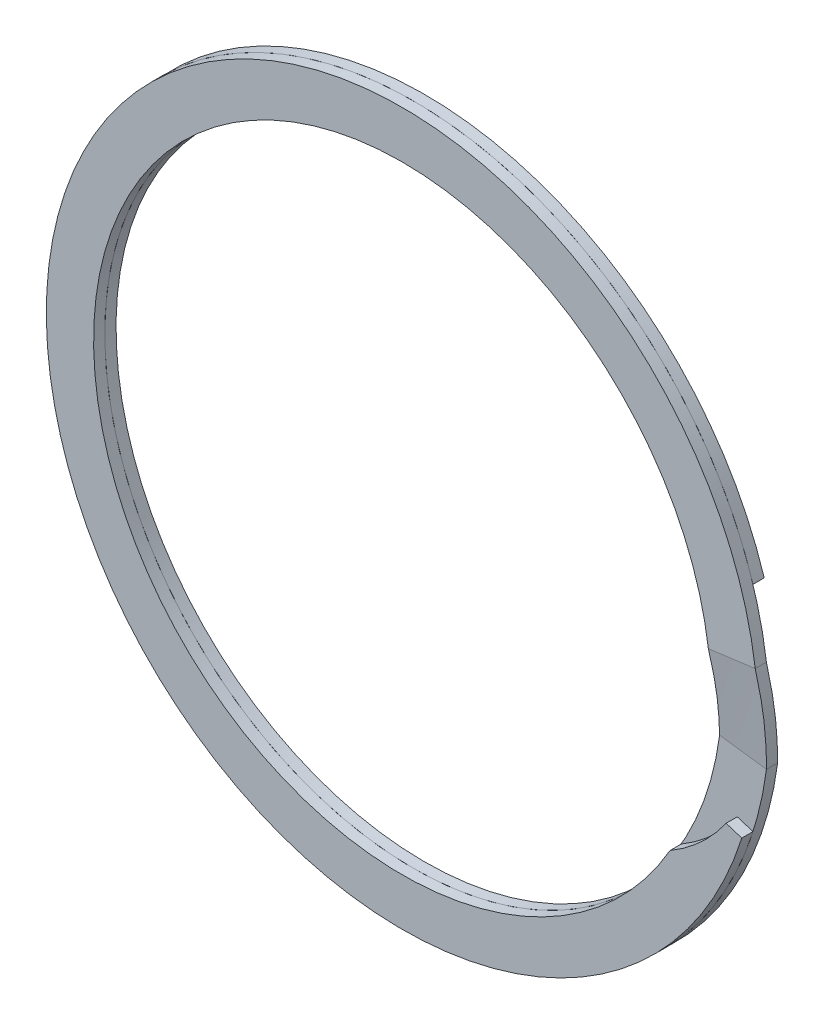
SolidWorks part; units mm, degrees
ref_plane "Front" through (0, 0, 0) normal (0, 0, 1) x (1, 0, 0)
ref_plane "Top" through (0, 0, 0) normal (0, 1, 0) x (1, 0, 0)
ref_plane "Right" through (0, 0, 0) normal (1, 0, 0) x (0, 0, -1)
sketch "Layout" plane through (0, 0, 0) normal (0, 0, 1) x (1, 0, 0)
  line L0 (-38.25, 0) -> (38.25, 0) construction
  line L1 (0, 0) -> (36.4797, 11.502) construction
  line L2 (0, 0) -> (36.4797, -11.502) construction
  line L3 (0, 0) -> (2.41, 0) construction
  line L4 (38.25, 0) -> (40.66, 0) construction
  line L9 (-38.25, 0) -> (-38.25, 2.41) construction
  line L10 (0, 0) -> (37.9228, 4.9926) construction
  line L11 (0, 0) -> (37.9228, -4.9926) construction
  circle A0 centre (0, 0) radius 33.17 construction
  circle A1 centre (0, 0) radius 38.25 construction
  circle A2 centre (19.125, 0) radius 19.125 construction
sketch "Sketch5" plane through (0, 0, 0) normal (0, 1, 0) x (1, 0, 0)
  line L0 (-38.25, 0) -> (38.25, 0) construction
  line L1 (33.17, 0.0025) -> (38.25, 0.0025) construction
  line L2 (33.17, 0.0025) -> (33.17, 1.205) construction
  line L3 (33.17, 1.205) -> (38.25, 1.205) construction
  line L4 (38.25, 0.0025) -> (38.25, 1.205) construction
  line L5 (0, 0) -> (0, 11.5256) construction
  line L9 (-38.25, 0) -> (38.25, 0) construction
  line L15 (33.17, -0.0025) -> (38.25, -0.0025) construction
  line L16 (33.17, -0.0025) -> (33.17, -1.205) construction
  line L17 (38.25, -0.0025) -> (38.25, -1.205) construction
  line L18 (33.17, -1.205) -> (38.25, -1.205) construction
  line L19 (-38.25, -0.0025) -> (-38.25, -1.205)
  line L20 (-38.25, 0.0025) -> (-38.25, 1.205)
  line L21 (-33.17, -0.0025) -> (-38.25, -0.0025)
  line L22 (-33.17, 0.0025) -> (-38.25, 0.0025)
  line L23 (-33.17, -1.205) -> (-38.25, -1.205)
  line L24 (-33.17, -0.0025) -> (-33.17, -1.205)
  line L25 (-33.17, 0.0025) -> (-33.17, 1.205)
  line L26 (-33.17, 1.205) -> (-38.25, 1.205)
  point P6 (33.17, 0)
revolve "Revolve1" add sketch "Sketch5" angle 345 mid plane about L5
sketch3d "3DSketch1"
  line L0 (40.8207, -5.3741, -0.0025) -> (2.3894, -0.3146, -0.0025)
  line L1 (37.9228, 4.9926, 1.205) -> (32.8862, 4.3296, 1.205) construction
  line L2 (40.5006, 5.332, 1.205) -> (2.0693, 0.2724, 1.205)
  line L3 (37.9228, -4.9926, -0.0025) -> (32.8862, -4.3296, -0.0025) construction
  line L4 (2.0693, 0.2724, 1.205) -> (2.3894, -0.3146, -0.0025)
  line L5 (40.8207, -5.3741, -0.0025) -> (40.5006, 5.332, 1.205)
  line L6 (40.66, 0, 0) -> (40.66, 0, 0.6036) construction
  line L7 (2.0693, 0.2724, 1.205) -> (0, 0, 0) construction
  line L10 (0, 0, 0) -> (2.41, 0, 0) construction
  line L11 (0, 0, 0) -> (2.3894, -0.3146, -0.0025) construction
surface "Surface-Fill1" sketch "3DSketch1"
sketch "Sketch8" plane through (0, 0, 0) normal (0, 0, 1) x (1, 0, 0)
  circle A0 centre (0, 0) radius 33.17 construction
  circle A1 centre (0, 0) radius 38.25 construction
  circle A2 centre (0, 0) radius 33.17
  circle A3 centre (0, 0) radius 38.25
surface "Surface-Trim1"
sketch3d "3DSketch2"
  line L4 (32.8862, 4.3296, 0.0025) -> (37.9228, 4.9926, 0.0025)
  line L5 (37.9228, 4.9926, 0.0025) -> (37.9228, 4.9926, 1.205)
  line L6 (37.9228, 4.9926, 1.205) -> (32.8862, 4.3296, 1.205)
  line L7 (32.8862, 4.3296, 1.205) -> (32.8862, 4.3296, 0.0025)
  line L8 (32.8862, 4.3296, 0.0025) -> (37.9228, 4.9926, 0.0025)
  line L9 (37.9228, 4.9926, 0.0025) -> (37.9228, 4.9926, 1.205)
  line L10 (37.9228, 4.9926, 1.205) -> (32.8862, 4.3296, 1.205)
  line L11 (32.8862, 4.3296, 1.205) -> (32.8862, 4.3296, 0.0025)
  line L12 (32.8862, -4.3296, -0.0025) -> (37.9228, -4.9926, -0.0025)
  line L13 (37.9228, -4.9926, -0.0025) -> (37.9228, -4.9926, -1.205)
  line L14 (37.9228, -4.9926, -1.205) -> (32.8862, -4.3296, -1.205)
  line L15 (32.8862, -4.3296, -1.205) -> (32.8862, -4.3296, -0.0025)
  line L16 (32.8862, -4.3296, -0.0025) -> (37.9228, -4.9926, -0.0025)
  line L17 (37.9228, -4.9926, -0.0025) -> (37.9228, -4.9926, -1.205)
  line L18 (37.9228, -4.9926, -1.205) -> (32.8862, -4.3296, -1.205)
  line L19 (32.8862, -4.3296, -1.205) -> (32.8862, -4.3296, -0.0025)
  dimension "D1" = 0
  dimension "D2" = 0
loft "Loft1" add
delete or keep bodies "Body-Delete1" type delete bodies bodies 115
sketch "Sketch10" plane through (0, 0, -1.205) normal (0, 0, -1) x (-1, 0, 0)
  line L2 (0, 0) -> (-36.4797, 11.502) construction
  line L5 (-34.7913, 10.9696) -> (-36.4797, 11.502)
  line L6 (38.25, 0) -> (-38.25, 0) construction
  line L7 (0, 0) -> (-37.9228, 4.9926) construction
  line L8 (-32.8862, 4.3296) -> (-37.9228, 4.9926)
  line L9 (38.25, 0) -> (-38.25, 0) construction
  line L10 (-32.8862, -4.3296) -> (-37.9228, -4.9926) construction
  line L11 (-34.7913, -10.9696) -> (-36.4797, -11.502) construction
  circle A2 centre (-19.125, 0) radius 19.125 construction
  circle A3 centre (0, 0) radius 33.17 construction
  arc A4 (-28.7647, 16.5179) -> (-32.8862, 4.3296) centre (0, 0) ccw
  arc A5 (-28.7647, 16.5179) -> (-34.7913, 10.9696) centre (-19.125, 0) ccw
  circle A6 centre (0, 0) radius 38.25 construction
  arc A7 (-36.4797, 11.502) -> (-37.9228, 4.9926) centre (0, 0) ccw
  arc A8 (-36.4797, -11.502) -> (-37.9228, -4.9926) centre (0, 0) cw construction
  arc A9 (-28.7647, -16.5179) -> (-34.7913, -10.9696) centre (-19.125, 0) cw construction
  arc A10 (-28.7647, -16.5179) -> (-32.8862, -4.3296) centre (0, 0) cw construction
extrude "Cut-Extrude2" cut sketch "Sketch10" against normal up to surface (1.2025 mm away)
sketch "Sketch11" plane through (0, 0, 1.205) normal (0, 0, 1) x (1, 0, 0)
  line L0 (32.8862, -4.3296) -> (37.9228, -4.9926) construction
  line L1 (34.7913, -10.9696) -> (36.4797, -11.502) construction
  line L2 (32.8862, -4.3296) -> (37.9228, -4.9926)
  line L3 (34.7913, -10.9696) -> (36.4797, -11.502)
  arc A0 (28.7647, -16.5179) -> (34.7913, -10.9696) centre (19.125, 0) ccw construction
  arc A1 (28.7647, -16.5179) -> (32.8862, -4.3296) centre (0, 0) ccw construction
  arc A2 (36.4797, -11.502) -> (37.9228, -4.9926) centre (0, 0) ccw construction
  arc A3 (28.7647, -16.5179) -> (34.7913, -10.9696) centre (19.125, 0) ccw
  arc A4 (28.7647, -16.5179) -> (32.8862, -4.3296) centre (0, 0) ccw
  arc A5 (36.4797, -11.502) -> (37.9228, -4.9926) centre (0, 0) ccw
extrude "Cut-Extrude3" cut sketch "Sketch11" against normal up to surface (1.2075 mm away)
sketch "Sketch12" plane through (0, 0, 0) normal (0, 0, 1) x (1, 0, 0)
  circle A0 centre (0, 0) radius 33.17 construction
  arc A1 (32.8862, 4.3296) -> (28.7647, -16.5179) centre (0, 0) ccw construction
sketch "Sketch13" plane through (0, 0, 0) normal (0, 0, 1) x (1, 0, 0)
  line L0 (23.4547, -23.4547) -> (27.0468, -27.0468) construction
  line L1 (0, 0) -> (38.2603, 0) construction
  arc A0 (32.8862, 4.3296) -> (28.7647, -16.5179) centre (0, 0) ccw construction
  arc A1 (37.9228, 4.9926) -> (36.4797, -11.502) centre (0, 0) ccw construction
  spline S0 degree 3 poles (37.9228, -4.9926) (38.0213, -4.1621) (38.2856, -1.6735) (38.2951, 1.6754) (38.016, 4.1617) (37.9228, 4.9926) knots 0 0 0 0 0.250609 0.749558 1 1 1 1 construction
  dimension "D1" = 45
equation "\"D1@Sketch5\"=\"thickness@Layout\"/2.0"
equation "\"D1@Revolve1\"=360-\"D2@Layout\""
